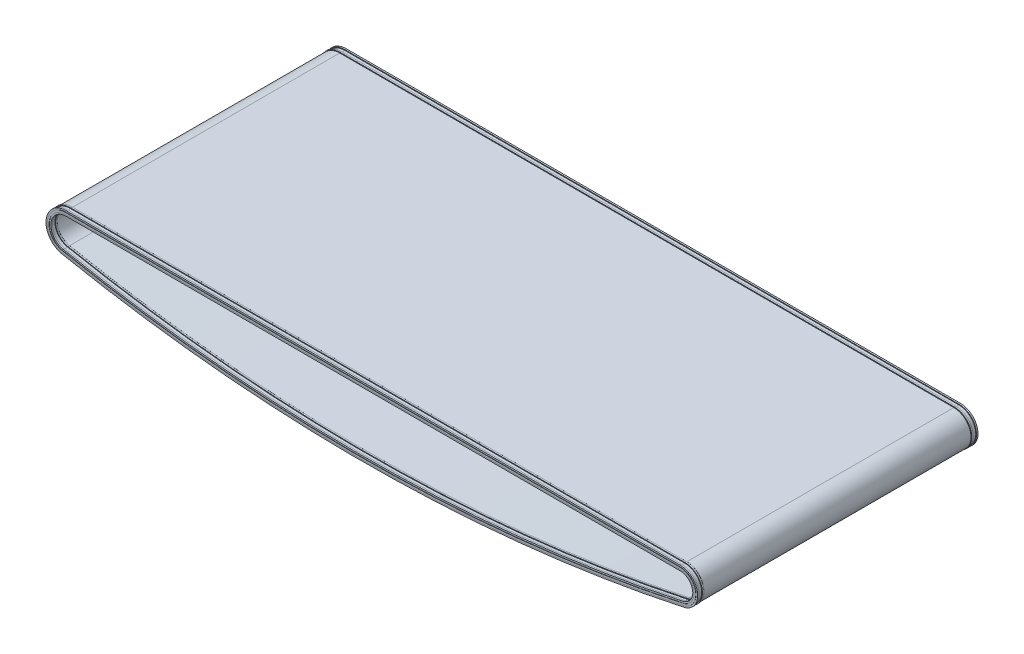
SolidWorks part; units mm, degrees
ref_plane "Plan de face" through (0, 0, 0) normal (0, 0, 1) x (1, 0, 0)
ref_plane "Plan de dessus" through (0, 0, 0) normal (0, 1, 0) x (1, 0, 0)
ref_plane "Plan de droite" through (0, 0, 0) normal (1, 0, 0) x (0, 0, -1)
sketch "Esquisse1" plane through (0, 0, 0) normal (0, 0, 1) x (1, 0, 0)
  line L0 (744.9939, 0) -> (-744.9939, 0)
  line L3 (0, -92.6976) -> (0, 92.6976) construction
  arc A0 (-744.9939, 0) -> (-753.3075, -84.4011) centre (-744.9939, -42.61) ccw
  arc A2 (752.7037, -72.3181) -> (744.9939, 0) centre (744.9939, -36.57) ccw
  arc A4 (-753.3075, -84.4011) -> (752.7037, -72.3181) centre (-29.4475, 3554.2974) ccw
  point P2 (0, 0)
  dimension "D1" = 3710
  dimension "D2" = 85.22
  dimension "D4" = 1490
  dimension "D3" = 73.14
sketch "Esquisse2" plane through (0, 0, 0) normal (1, 0, 0) x (0, 0, -1)
  line L0 (-340.805, 2.2) -> (-340.805, -2.2)
  line L1 (-340.805, -2.2) -> (-340.075, -2.2)
  line L2 (-340.075, -2.2) -> (-340.075, -5.9)
  line L3 (-340.075, -5.9) -> (-336.375, -5.9)
  line L4 (-336.375, -5.9) -> (-336.375, -4.25)
  line L5 (-336.375, -4.25) -> (-328.625, -4.25)
  line L6 (-328.625, -4.25) -> (-328.625, -5.9)
  line L7 (-328.625, -5.9) -> (-324.925, -5.9)
  line L8 (-324.925, -5.9) -> (-324.925, -2.2)
  line L9 (-324.925, -2.2) -> (-324.195, -2.2)
  line L10 (-324.195, -2.2) -> (-324.195, -1.5)
  line L11 (-324.195, -1.5) -> (-323.995, -1.5)
  line L12 (-323.995, -1.5) -> (-323.995, -5)
  line L13 (-323.995, -5) -> (323.995, -5)
  line L14 (323.995, -5) -> (323.995, -1.5)
  line L15 (323.995, -1.5) -> (324.195, -1.5)
  line L16 (324.195, -1.5) -> (324.195, -2.2)
  line L17 (324.195, -2.2) -> (324.925, -2.2)
  line L18 (324.925, -2.2) -> (324.925, -5.9)
  line L19 (324.925, -5.9) -> (328.625, -5.9)
  line L20 (328.625, -5.9) -> (328.625, -4.25)
  line L21 (328.625, -4.25) -> (336.375, -4.25)
  line L22 (336.375, -4.25) -> (336.375, -5.9)
  line L23 (336.375, -5.9) -> (340.075, -5.9)
  line L24 (340.075, -5.9) -> (340.075, -2.2)
  line L25 (340.075, -2.2) -> (340.805, -2.2)
  line L26 (340.805, -2.2) -> (340.805, 2.2)
  line L27 (340.805, 2.2) -> (340.075, 2.2)
  line L28 (340.075, 2.2) -> (340.075, 5.9)
  line L29 (340.075, 5.9) -> (336.375, 5.9)
  line L30 (336.375, 5.9) -> (336.375, 4.25)
  line L31 (336.375, 4.25) -> (328.625, 4.25)
  line L32 (328.625, 4.25) -> (328.625, 5.9)
  line L33 (328.625, 5.9) -> (324.925, 5.9)
  line L34 (324.925, 5.9) -> (324.925, 2.2)
  line L35 (324.925, 2.2) -> (324.195, 2.2)
  line L36 (324.195, 2.2) -> (324.195, 1.5)
  line L37 (324.195, 1.5) -> (323.995, 1.5)
  line L38 (323.995, 1.5) -> (323.995, 5)
  line L39 (323.995, 5) -> (-323.995, 5)
  line L40 (-323.995, 1.5) -> (-324.195, 1.5)
  line L41 (-324.195, 1.5) -> (-324.195, 2.2)
  line L42 (-324.195, 2.2) -> (-324.925, 2.2)
  line L43 (-324.925, 2.2) -> (-324.925, 5.9)
  line L44 (-324.925, 5.9) -> (-328.625, 5.9)
  line L45 (-328.625, 5.9) -> (-328.625, 4.25)
  line L46 (-328.625, 4.25) -> (-336.375, 4.25)
  line L47 (-336.375, 4.25) -> (-336.375, 5.9)
  line L48 (-336.375, 5.9) -> (-340.075, 5.9)
  line L49 (-340.075, 5.9) -> (-340.075, 2.2)
  line L50 (-340.075, 2.2) -> (-340.805, 2.2)
  line L51 (-323.995, 1.5) -> (-323.995, 5)
  line L52 (-340.805, 0) -> (340.805, 0) construction
  line L53 (0, -5) -> (0, 5) construction
  point P57 (332.5, -4.25)
  point P59 (-332.5, -4.25)
  dimension "D1" = 0.73
  dimension "D2" = 3.7
  dimension "D3" = 665
  dimension "D4" = 7.75
  dimension "D5" = 4.4
  dimension "D6" = 11.8
  dimension "D7" = 8.5
  dimension "D8" = 3
  dimension "D9" = 10
  dimension "D10" = 0.2
sweep "Balayage1" add profiles "Esquisse2" path "Esquisse1"
